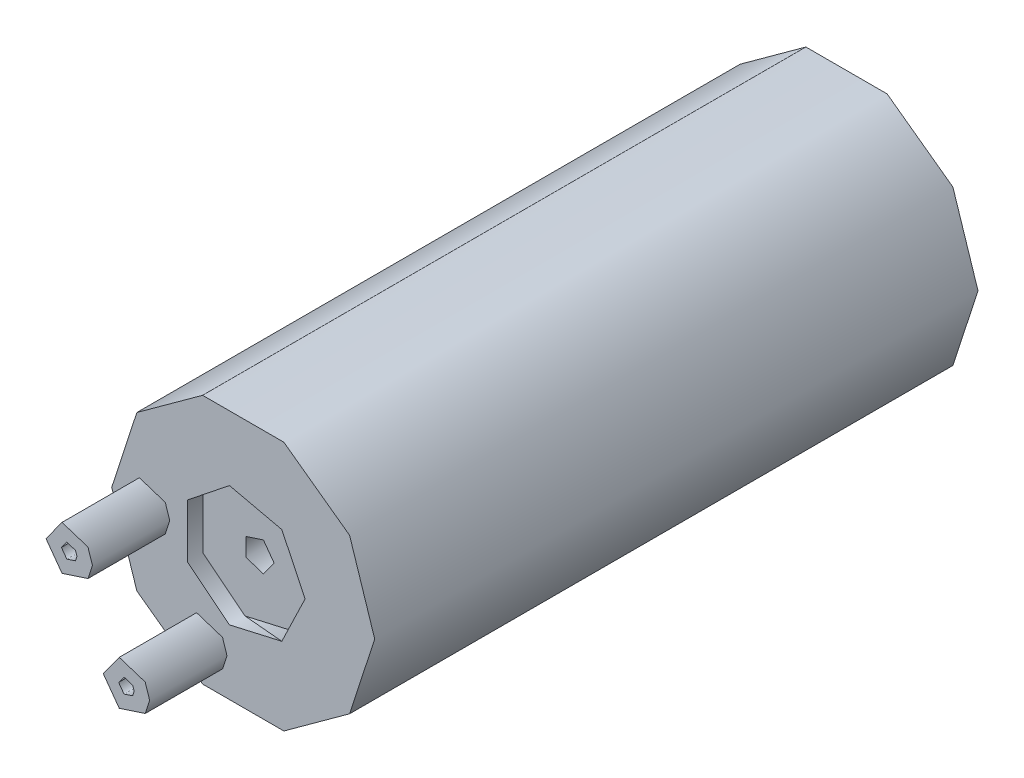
SolidWorks part; units mm, degrees
ref_plane "Plan de face" through (0, 0, 0) normal (0, 0, 1) x (1, 0, 0)
ref_plane "Plan de dessus" through (0, 0, 0) normal (0, 1, 0) x (1, 0, 0)
ref_plane "Plan de droite" through (0, 0, 0) normal (1, 0, 0) x (0, 0, -1)
sketch "Esquisse1" plane through (0, 0, 0) normal (0, 0, 1) x (1, 0, 0)
  circle A0 centre (0, 0) radius 42.5
  dimension "D1" = 85
extrude "Boss.-Extru.1" add sketch "Esquisse1" along normal blind 195
sketch "Esquisse2" plane through (0, 0, 0) normal (0, 0, -1) x (-1, 0, 0)
  circle A0 centre (0, 0) radius 20.5
  dimension "D1" = 41
extrude "Enlèv. mat.-Extru.1" cut sketch "Esquisse2" against normal blind 5
sketch "Esquisse3" plane through (0, 0, 195) normal (0, 0, 1) x (1, 0, 0)
  circle A0 centre (0, 0) radius 20
  dimension "D1" = 40
extrude "Enlèv. mat.-Extru.2" cut sketch "Esquisse3" against normal blind 5
sketch "Esquisse4" plane through (0, 0, 190) normal (0, 0, 1) x (1, 0, 0)
  circle A0 centre (0, 0) radius 5
  dimension "D1" = 10
extrude "Enlèv. mat.-Extru.3" cut sketch "Esquisse4" against normal up to next
sketch "Esquisse5" plane through (0, 0, 0) normal (0, 0, -1) x (-1, 0, 0)
  circle A0 centre (31.25, 0) radius 7.5
  circle A1 centre (12.754, -28.5289) radius 7.5
  circle A2 centre (0, 0) radius 31.25 construction
  dimension "D1" = 15
  dimension "D2" = 15
  dimension "D4" = 62.5
  dimension "D3" = 34
extrude "Boss.-Extru.2" add sketch "Esquisse5" along normal blind 25
sketch "Esquisse6" plane through (0, 0, 195) normal (0, 0, 1) x (1, 0, 0)
  circle A0 centre (-31.25, 0) radius 7.5
  circle A2 centre (-12.754, -28.5289) radius 7.5
  circle A4 centre (0, 0) radius 31.25 construction
  circle A6 centre (-31.25, 0) radius 2.5
  circle A7 centre (-12.754, -28.5289) radius 2.5
  dimension "D1" = 34
  dimension "D2" = 62.5
  dimension "D3" = 15
  dimension "D4" = 15
  dimension "D5" = 0
  dimension "D6" = 5
  dimension "D7" = 5
extrude "Boss.-Extru.3" add sketch "Esquisse6" along normal blind 25
sketch "Esquisse10" plane through (0, 0, -25) normal (0, 0, -1) x (-1, 0, 0)
  circle A0 centre (31.25, 0) radius 2.5
  circle A1 centre (12.754, -28.5289) radius 2.5
  circle A2 centre (12.754, -28.5289) radius 7.5 construction
  dimension "D1" = 5
  dimension "D2" = 5
  dimension "D3" = 0
extrude "Enlèv. mat.-Extru.4" cut sketch "Esquisse10" against normal blind 20
